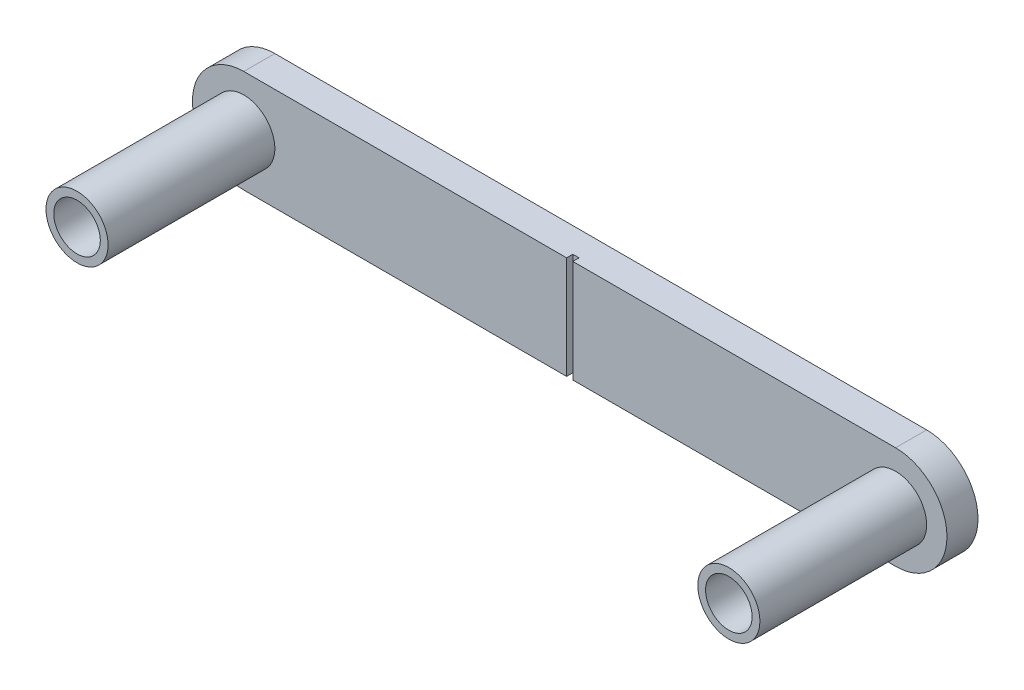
SolidWorks part; units mm, degrees
ref_plane "Plan1" through (0, 0, 0) normal (0, 0, 1) x (1, 0, 0)
ref_plane "Plan2" through (0, 0, 0) normal (0, 1, 0) x (1, 0, 0)
ref_plane "Plan3" through (0, 0, 0) normal (1, 0, 0) x (0, 0, -1)
sketch "Esquisse7" plane through (0, 0, 0) normal (0, 0, 1) x (1, 0, 0)
  circle A0 centre (353.5953, 142.141) radius 10
  dimension "D1" = 20
extrude "Base-Extrusion" add sketch "Esquisse7" against normal blind 53.73
sketch "Esquisse8" plane through (0, 0, -53.73) normal (0, 0, -1) x (-1, 0, 0)
  line L0 (-143.5953, 158.6847) -> (-353.5953, 158.6847)
  line L1 (-353.5953, 125.5972) -> (-143.5953, 125.5972)
  arc A0 (-353.5953, 158.6847) -> (-353.5953, 125.5972) centre (-353.5953, 142.141) ccw
  arc A1 (-143.5953, 158.6847) -> (-143.5953, 125.5972) centre (-143.5953, 142.141) cw
  dimension "D1" = 210
extrude "Boss.-Extru.1" add sketch "Esquisse8" along normal blind 10
sketch "Esquisse10" plane through (0, 0, -53.73) normal (0, 0, 1) x (1, 0, 0)
  circle A0 centre (143.5953, 142.141) radius 10
  dimension "D1" = 20
extrude "Boss.-Extru.2" add sketch "Esquisse10" along normal blind 53.73
sketch "Esquisse11" plane through (0, 0, -53.73) normal (0, 0, 1) x (1, 0, 0)
  line L0 (247.5953, 158.6847) -> (249.5953, 158.6847)
  line L2 (247.5953, 125.2146) -> (249.5953, 125.2146)
  line L3 (247.5953, 158.6847) -> (247.5953, 125.2146)
  line L4 (249.5953, 158.6847) -> (249.5953, 125.2146)
extrude "Enlèv. mat.-Extru.2" cut sketch "Esquisse11" against normal blind 2
sketch "Esquisse12" plane through (0, 0, 0) normal (0, 0, 1) x (1, 0, 0)
  circle A0 centre (143.5953, 142.141) radius 7.5
  circle A1 centre (353.5953, 142.141) radius 7.5
  dimension "D1" = 15
  dimension "D2" = 15
extrude "Enlèv. mat.-Extru.3" cut sketch "Esquisse12" against normal through all
scale "Echelle1"
